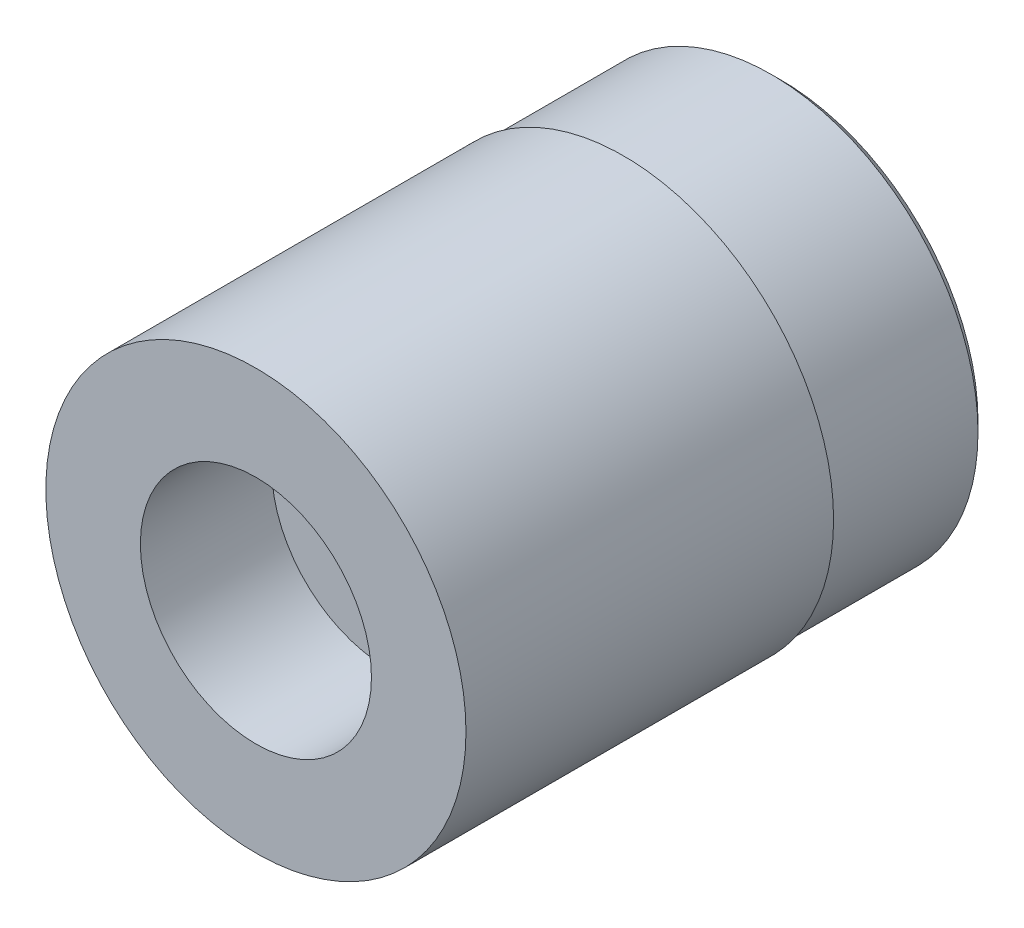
SolidWorks part; units mm, degrees
ref_plane "Front Plane" through (0, 0, 0) normal (0, 0, 1) x (1, 0, 0)
ref_plane "Top Plane" through (0, 0, 0) normal (0, 1, 0) x (1, 0, 0)
ref_plane "Right Plane" through (0, 0, 0) normal (1, 0, 0) x (0, 0, -1)
sketch "Sketch1" plane through (0, 0, 0) normal (1, 0, 0) x (0, 0, -1)
  line L2 (0, 4) -> (0, 2.2)
  line L3 (9.75, 4) -> (0, 4)
  line L4 (-3.7979, 0) -> (49996.2021, 0) construction
  line L8 (10, 1.15) -> (2.5, 1.15)
  line L9 (2.5, 2.2) -> (2.5, 1.15)
  line L10 (2.5, 2.2) -> (0, 2.2)
  line L12 (10, 1.15) -> (10, 3.75)
  line L16 (10, 3.75) -> (9.75, 4)
  dimension "D1" = 10
  dimension "D2" = 45
  dimension "D3" = 0.25
  dimension "D4" = 8
  dimension "D5" = 4.4
  dimension "D6" = 2.5
  dimension "D7" = 2.3
revolve "Revolve1" add sketch "Sketch1" angle 360 about L4
sketch "Sketch4" plane through (0, 0, 0) normal (1, 0, 0) x (0, 0, -1)
  line L0 (0, 0) -> (50000, 0) construction
  line L1 (10, -3.75) -> (10, 3.75) construction
  line L2 (7, 4.935) -> (10, 4.935)
  line L3 (7, 4.935) -> (7, 3.935)
  line L4 (7, 3.935) -> (10, 3.935)
  line L5 (10, 4.935) -> (10, 3.935)
  line L6 (9.75, 4) -> (0, 4) construction
  line L9 (0, 4.4) -> (0, -4.4) construction
  dimension "D1" = 1
  dimension "D2" = 0.065
  dimension "D3" = 7
revolve "Cut-Revolve1" cut sketch "Sketch4" angle 360 about L0
